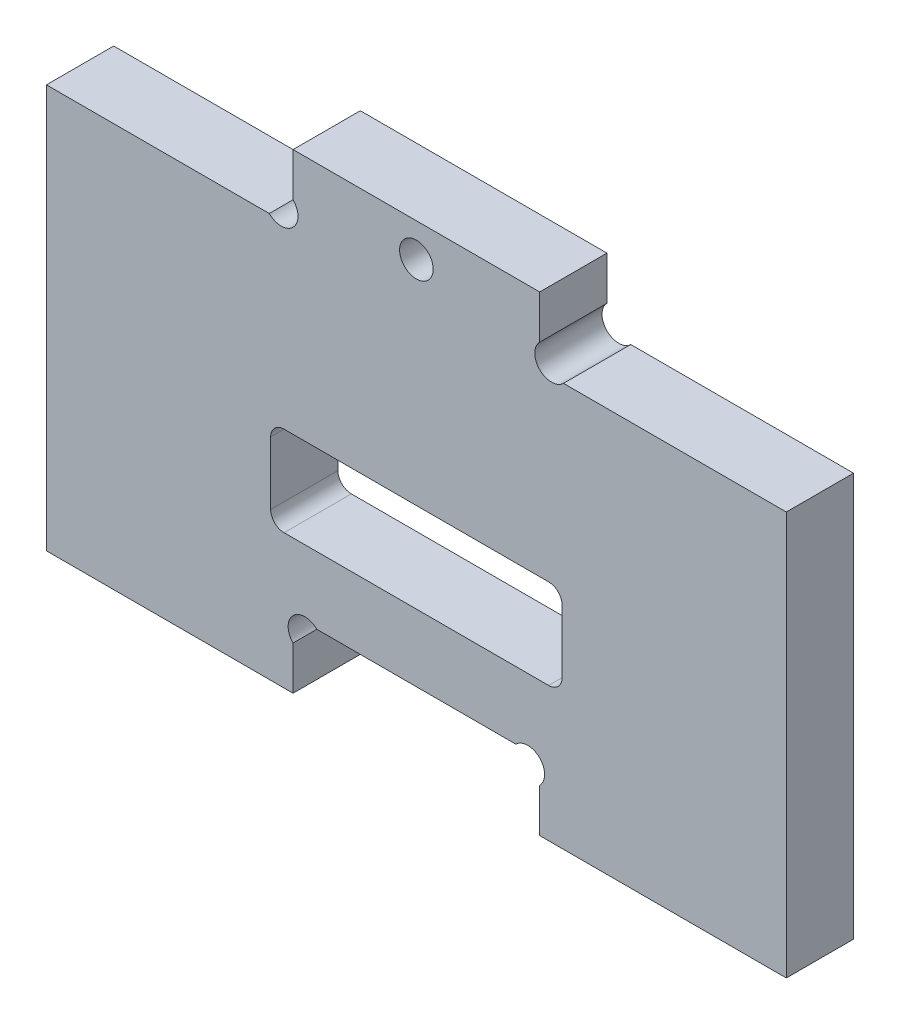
SolidWorks part; units mm, degrees
ref_plane "Plan de face" through (0, 0, 0) normal (0, 0, 1) x (1, 0, 0)
ref_plane "Plan de dessus" through (0, 0, 0) normal (0, 1, 0) x (1, 0, 0)
ref_plane "Plan de droite" through (0, 0, 0) normal (1, 0, 0) x (0, 0, -1)
sketch "Esquisse1" plane through (0, 0, 0) normal (0, 0, 1) x (1, 0, 0)
  line L0 (-10.2131, 0) -> (89.0677, 0) construction
  line L1 (0, -7.0067) -> (0, 50.9097) construction
  line L2 (-10.2131, 36) -> (89.0677, 36) construction
  line L3 (33, 46.5397) -> (33, -13.8946) construction
  line L4 (66, 50.9097) -> (66, -13.8946) construction
  line L5 (89.0677, 6) -> (-10.2131, 6) construction
  line L6 (22, -13.8946) -> (22, 43.5114) construction
  line L7 (22, 6) -> (36.0049, -8.0049) construction
  line L8 (17.3528, 12) -> (60.3047, 12) construction
  line L9 (-10.2131, 42) -> (89.0677, 42) construction
  line L10 (22, 36) -> (13.092, 44.908) construction
  line L11 (22, 38.1213) -> (22, 42)
  line L12 (22, 3.8787) -> (22, 0)
  line L13 (44, 38.1213) -> (44, 42)
  line L14 (44, 3.8787) -> (44, 0)
  line L15 (22, 42) -> (44, 42)
  line L16 (46.1213, 36) -> (66, 36)
  line L17 (66, 36) -> (66, 0)
  line L18 (66, 0) -> (44, 0)
  line L19 (41.8787, 6) -> (24.1213, 6)
  line L20 (22, 0) -> (0, 0)
  line L21 (0, 0) -> (0, 36)
  line L22 (0, 36) -> (19.8787, 36)
  line L23 (60.3047, 20) -> (17.3528, 20) construction
  line L24 (46, 22.652) -> (46, 9.9971) construction
  line L25 (46, 18.8) -> (46, 13.2)
  line L26 (20, 18.8) -> (20, 13.2)
  line L27 (21.2, 20) -> (44.8, 20)
  line L28 (21.2, 12) -> (44.8, 12)
  line L29 (28.5739, 39) -> (41.2912, 39) construction
  arc A0 (24.1213, 6) -> (22, 3.8787) centre (23.0607, 4.9393) ccw
  arc A1 (19.8787, 36) -> (22, 38.1213) centre (20.9393, 37.0607) ccw
  arc A2 (46.1213, 36) -> (44, 38.1213) centre (45.0607, 37.0607) cw
  arc A3 (41.8787, 6) -> (44, 3.8787) centre (42.9393, 4.9393) cw
  arc A4 (20, 18.8) -> (21.2, 20) centre (21.2, 18.8) cw
  arc A5 (20, 13.2) -> (21.2, 12) centre (21.2, 13.2) ccw
  arc A6 (46, 13.2) -> (44.8, 12) centre (44.8, 13.2) cw
  arc A7 (46, 18.8) -> (44.8, 20) centre (44.8, 18.8) ccw
  circle A8 centre (33, 39) radius 1.5
  point P52 (20, 20)
  point P55 (20, 12)
  point P58 (46, 12)
  point P61 (46, 20)
  dimension "D10" = 20
  dimension "D12" = 1.2
  dimension "D1" = 6
  dimension "D2" = 30
  dimension "D3" = 11
  dimension "D4" = 33
  dimension "D5" = 66
  dimension "D6" = 45
  dimension "D7" = 6
  dimension "D8" = 6
  dimension "D9" = 45
  dimension "D11" = 8
  dimension "D13" = 3
extrude "Extrusion1" add sketch "Esquisse1" along normal blind 6
